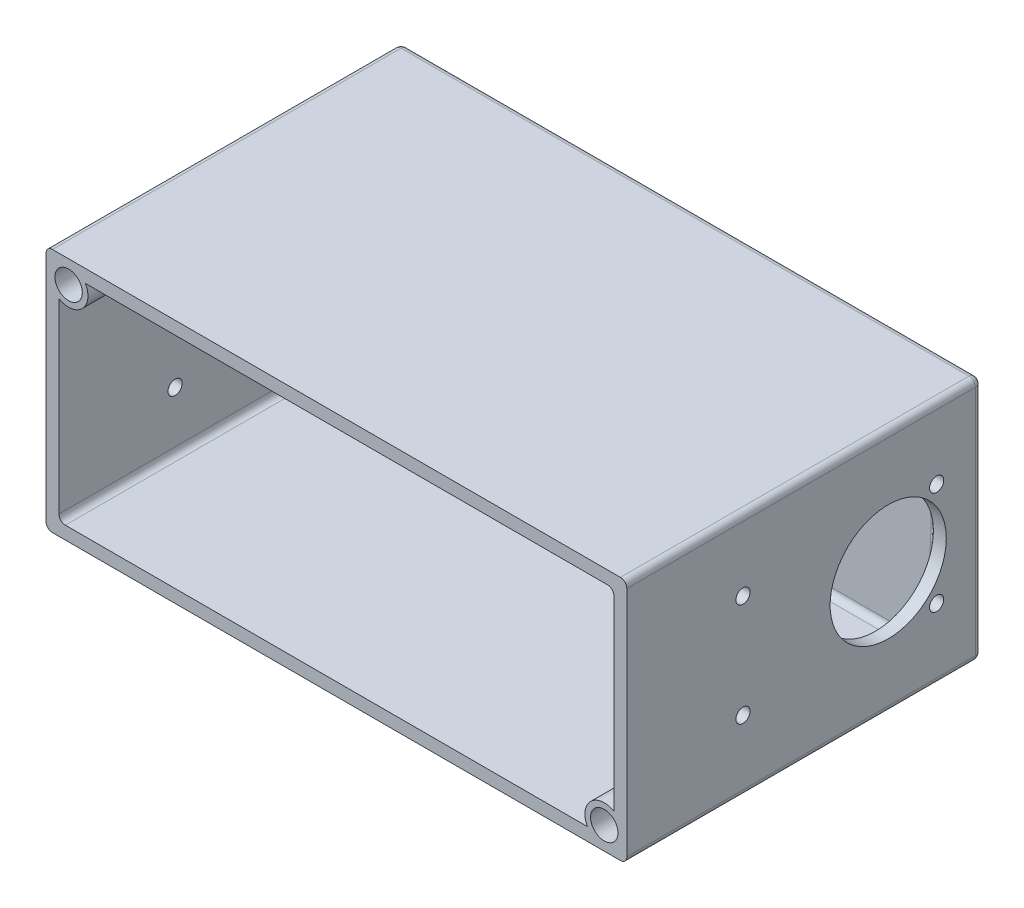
SolidWorks part; units mm, degrees
ref_plane "Ebene vorne" through (0, 0, 0) normal (0, 0, 1) x (1, 0, 0)
ref_plane "Ebene oben" through (0, 0, 0) normal (0, 1, 0) x (1, 0, 0)
ref_plane "Ebene rechts" through (0, 0, 0) normal (1, 0, 0) x (0, 0, -1)
sketch "Skizze1" plane through (0, 0, 0) normal (0, 0, 1) x (1, 0, 0)
  line L1 (45, -19) -> (-45, -19)
  line L2 (45, -19) -> (45, 19)
  line L3 (45, 19) -> (-45, 19)
  line L4 (-45, -19) -> (-45, 19)
  line L5 (45, -19) -> (-45, 19) construction
  line L6 (45, 19) -> (-45, -19) construction
  point P0 (0, 0)
  dimension "D1" = 90
  dimension "D2" = 38
extrude "Aufsatz-Linear austragen1" add sketch "Skizze1" along normal blind 5
sketch "Skizze2" plane through (0, 0, 5) normal (0, 0, 1) x (1, 0, 0)
  line L4 (43, 17) -> (-43, 17)
  line L5 (-43, 17) -> (-43, -17)
  line L6 (-43, -17) -> (43, -17)
  line L7 (43, -17) -> (43, 17)
  line L8 (-45, 19) -> (-45, -19)
  line L9 (-45, -19) -> (45, -19)
  line L10 (45, -19) -> (45, 19)
  line L11 (45, 19) -> (-45, 19)
  line L12 (-45, 19) -> (-45, -19)
  line L13 (-45, -19) -> (45, -19)
  line L14 (45, -19) -> (45, 19)
  line L15 (45, 19) -> (-45, 19)
  dimension "D1" = 0
  dimension "D2" = 2
extrude "Aufsatz-Linear austragen2" add sketch "Skizze2" along normal blind 50
sketch "Skizze4" plane through (45, 0, 0) normal (1, 0, 0) x (0, 0, -1)
  circle A0 centre (-14.5, 0) radius 9
  dimension "D1" = 18
extrude "Schnitt-Linear austragen1" cut sketch "Skizze4" against normal through all
sketch "Skizze5" plane through (45, 0, 0) normal (1, 0, 0) x (0, 0, -1)
  circle A0 centre (-37, 8) radius 1.1
  circle A1 centre (-7, 8) radius 1.1
  circle A2 centre (-7, -8) radius 1.1
  circle A3 centre (-37, -8) radius 1.1
  dimension "D1" = 2.2
  dimension "D4" = 8
  dimension "D2" = 16
  dimension "D3" = 30
  dimension "D5" = 7
extrude "Schnitt-Linear austragen2" cut sketch "Skizze5" against normal through all
sketch "Skizze7" plane through (0, 0, 5) normal (0, 0, 1) x (1, 0, 0)
  line L0 (43, 17) -> (-43, 17) construction
  line L1 (-43, 17) -> (-43, -17) construction
  line L2 (43, -17) -> (43, 17) construction
  line L3 (-43, -17) -> (43, -17) construction
  circle A0 centre (-41.5, 15.5) radius 3
  circle A1 centre (41.5, -15.5) radius 3
  dimension "D1" = 6
  dimension "D2" = 1.5
  dimension "D3" = 1.5
  dimension "D4" = 1.5
  dimension "D5" = 1.5
extrude "Aufsatz-Linear austragen3" add sketch "Skizze7" along normal up to surface (50 mm away)
sketch "Skizze8" plane through (0, 0, 55) normal (0, 0, 1) x (1, 0, 0)
  circle A0 centre (-41.5, 15.5) radius 2.125
  circle A1 centre (41.5, -15.5) radius 2.125
  dimension "D1" = 4.25
extrude "Schnitt-Linear austragen3" cut sketch "Skizze8" against normal blind 3.5 contours A0 | A1
sketch "Skizze9" plane through (0, 0, 55) normal (0, 0, 1) x (1, 0, 0)
  circle A0 centre (-41.5, 15.5) radius 0.75
  circle A1 centre (41.5, -15.5) radius 0.75
  dimension "D1" = 1.5
extrude "Schnitt-Linear austragen4" cut sketch "Skizze9" against normal blind 25
fillet "Verrundung1" radius 1 13 edges at (-43, -17, 30) (-2.049, -17, 5) (43, 2.049, 5) (43, 17, 30) (2.049, 17, 5) (-45, 19, 27.5) (0, 19, 0) (45, 19, 27.5) (45, 0, 0) (45, -19, 27.5) (0, -19, 0) (-45, -19, 27.5) (-45, 0, 0)
